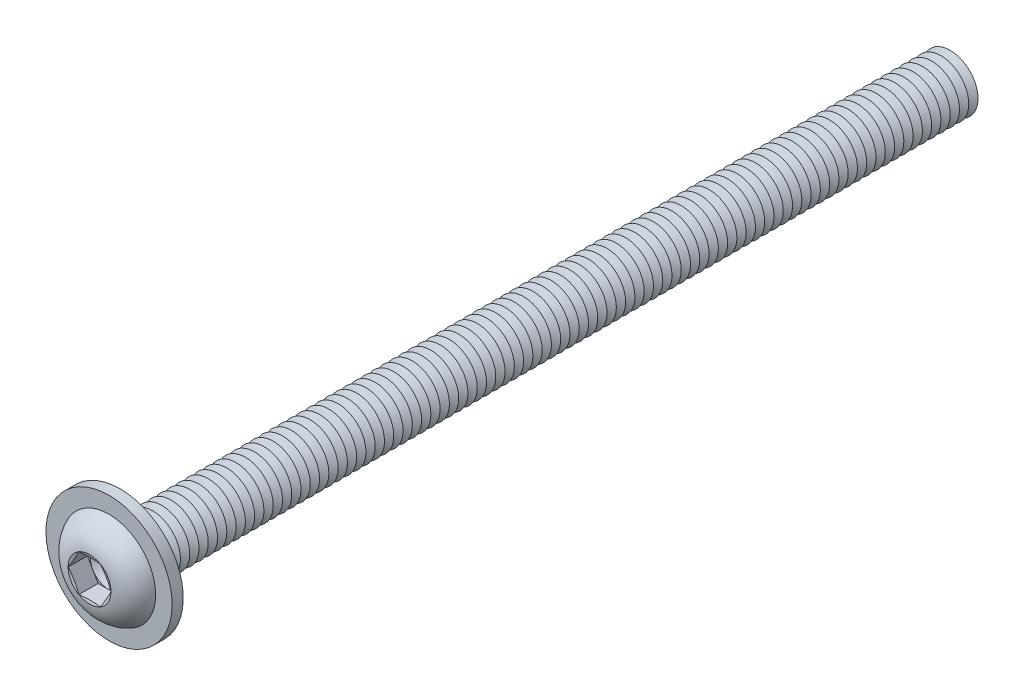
SolidWorks part; units mm, degrees
ref_plane "Front Plane" through (0, 0, 0) normal (0, 0, 1) x (1, 0, 0)
ref_plane "Top Plane" through (0, 0, 0) normal (0, 1, 0) x (1, 0, 0)
ref_plane "Right Plane" through (0, 0, 0) normal (1, 0, 0) x (0, 0, -1)
sketch "Sketch1" plane through (0, 0, 0) normal (1, 0, 0) x (0, 0, -1)
  line L0 (0, 3) -> (0, 5.25)
  line L3 (0, 3) -> (90, 3)
  line L4 (90, 3) -> (90, 0)
  line L5 (90, 0) -> (-3.3, 0) construction
  line L6 (-3.3, 0) -> (90, 0)
  line L7 (-3.3, 2.3094) -> (-3.3, 1.1547) construction
  line L8 (-3.3, 1.1547) -> (-3.3, 0)
  line L9 (-3.3, 2.3094) -> (-2.9906, 1.1547)
  line L10 (-2.9906, 1.1547) -> (-3.3, 1.1547)
  line L11 (90, 0) -> (22.7481, 0) construction
  line L12 (0, 5.25) -> (-3.3, 5.25) construction
  arc A1 (0, 5.25) -> (-3.3, 2.3094) centre (0, 1.928) ccw
  point P8 (90, 1.5)
  dimension "D1" = 10.5
  dimension "D2" = 6
  dimension "D3" = 3.3
  dimension "D4" = 4.6188
  dimension "D5" = 90
  dimension "D6" = 15
revolve "Revolve1" add sketch "Sketch1" angle 360 about L5
fillet "Fillet1" radius 0.5 1 edges at (0, 3, 0)
sketch "Sketch2" plane through (0, 0, 0) normal (1, 0, 0) x (0, 0, -1)
  line L0 (89.5, 3) -> (90.5, 3)
  line L1 (90, 3) -> (0.5, 3) construction
  line L2 (90.5, 3) -> (90, 2.134)
  line L3 (90, -3) -> (90, 3) construction
  line L4 (90, 2.134) -> (89.5, 3)
  dimension "D1" = 1
revolve "Cut-Revolve1" cut sketch "Sketch2" angle 360 about axis through (0, 0, -90) along (0, 0, -1)
pattern_linear "LPattern1" count 90 spacing 1 along (0, 0, 1) of "Cut-Revolve1"
sketch "Sketch3" plane through (0, 0, 3.3) normal (0, 0, 1) x (1, 0, 0)
  line L7 (1.1547, 2) -> (-1.1547, 2)
  line L8 (-1.1547, 2) -> (-2.3094, 0)
  line L9 (-2.3094, 0) -> (-1.1547, -2)
  line L10 (-1.1547, -2) -> (1.1547, -2)
  line L11 (1.1547, -2) -> (2.3094, 0)
  line L12 (2.3094, 0) -> (1.1547, 2)
  circle A0 centre (0, 0) radius 2 construction
  circle A3 centre (0, 0) radius 2.3094 construction
extrude "Cut-Extrude1" cut sketch "Sketch3" against normal blind 2.08
sketch "Sketch4" plane through (0, 0, 1.22) normal (0, 0, 1) x (1, 0, 0)
  line L1 (1.1547, 2) -> (-1.1547, 2) construction
  circle A0 centre (0, 0) radius 2
extrude "Cut-Extrude2" cut sketch "Sketch4" against normal through all draft 60
sketch "Sketch5" plane through (0, 0, 0) normal (0, 0, -1) x (-1, 0, 0)
  circle A0 centre (0, 0) radius 6.8
  circle A1 centre (0, 0) radius 3.5
  circle A2 centre (0, 0) radius 3.5 construction
  dimension "D1" = 13.6
extrude "Boss-Extrude1" add sketch "Sketch5" against normal blind 1.2
